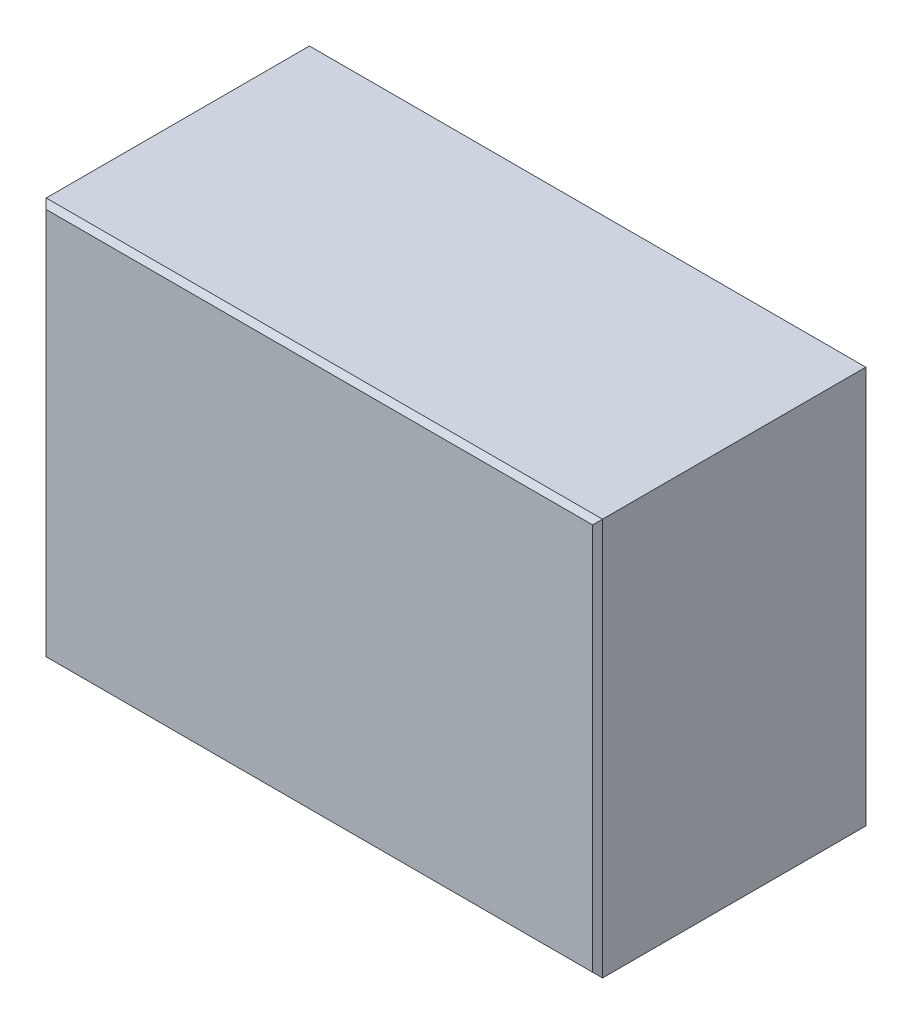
SolidWorks part; units mm, degrees
ref_plane "Face" through (0, 0, 0) normal (0, 0, 1) x (1, 0, 0)
ref_plane "Dessus" through (0, 0, 0) normal (0, 1, 0) x (1, 0, 0)
ref_plane "Droite" through (0, 0, 0) normal (1, 0, 0) x (0, 0, -1)
sketch "Esquisse1" plane through (0, 0, 0) normal (0, 0, 1) x (1, 0, 0)
  line L0 (-10, 0) -> (10, 0) construction
  line L1 (0, 10) -> (0, -10) construction
  line L3 (-5.6, 4) -> (5.6, 4)
  line L4 (-5.6, 4) -> (-5.6, -4)
  line L5 (-5.6, -4) -> (5.6, -4)
  line L6 (5.6, 4) -> (5.6, -4)
  dimension "D1" = 4
  dimension "D2" = 8
  dimension "D3" = 5.6
  dimension "D4" = 11.2
extrude "Boss.-Extru.1" add sketch "Esquisse1" along normal blind 5.5
chamfer "Chanfrein1" distance 0.1 angle 45 8 edges at (0, -4, 0) (5.6, 0, 0) (0, 4, 0) (-5.6, 0, 0) (0, 4, 5.5) (5.6, 0, 5.5) (0, -4, 5.5) (-5.6, 0, 5.5)
